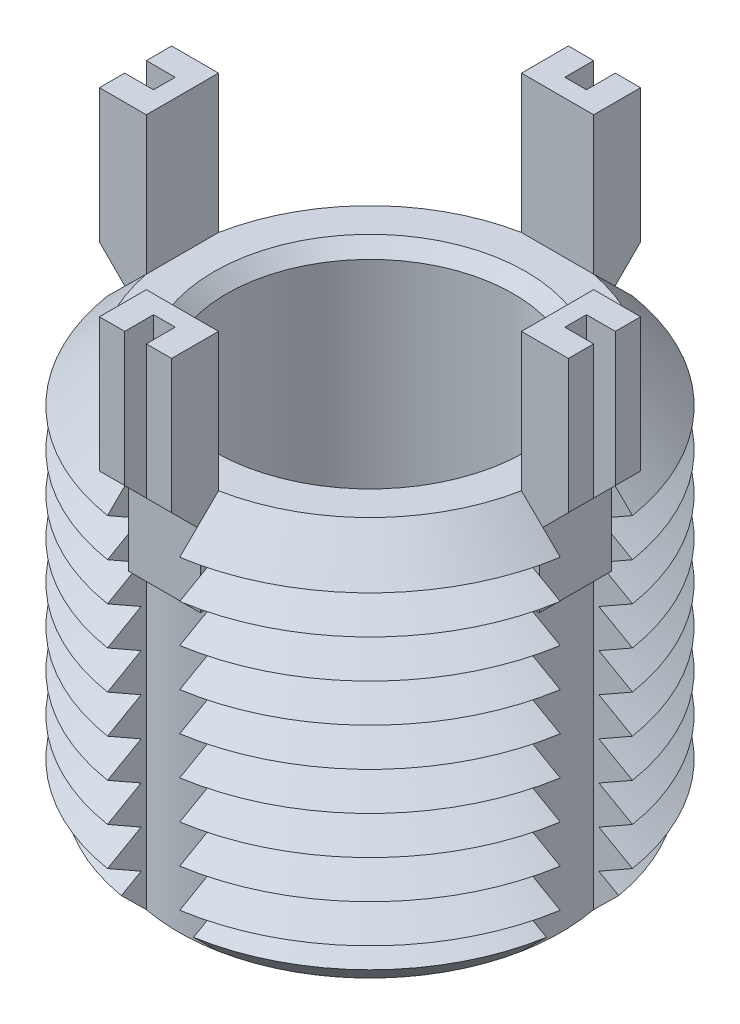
SolidWorks part; units mm, degrees
ref_plane "Front Plane" through (0, 0, 0) normal (0, 0, 1) x (1, 0, 0)
ref_plane "Top Plane" through (0, 0, 0) normal (0, 1, 0) x (1, 0, 0)
ref_plane "Right Plane" through (0, 0, 0) normal (1, 0, 0) x (0, 0, -1)
sketch "Sketch1" plane through (0, 0, 0) normal (0, 1, 0) x (1, 0, 0)
  circle A0 centre (0, 0) radius 12.7
  dimension "D1" = 25.4
extrude "Boss-Extrude1" add sketch "Sketch1" against normal blind 22.098
chamfer "Chamfer1" distance 2.117 angle 45 2 edges at (0, -22.098, 12.7) (0, 0, 12.7)
sketch "Sketch2" plane through (0, 0, 0) normal (1, 0, 0) x (0, 0, -1)
  line L0 (0, 0.8859) -> (0, -9.2617) construction
sketch "Sketch3" plane through (0, 0, 0) normal (1, 0, 0) x (0, 0, -1)
  line L0 (-12.7, -2.117) -> (-10.8666, -3.1755)
  line L1 (-10.8666, -3.1755) -> (-12.7, -4.234)
  line L2 (-12.7, -2.117) -> (-12.7, -19.981) construction
  line L3 (-12.7, -4.234) -> (-12.7, -2.117)
  dimension "D1" = 2.117
revolve "Cut-Revolve1" cut sketch "Sketch3" angle 360 about L0
pattern_linear "LPattern1" count 9 spacing 2.117 along (0, -1, 0) of "Cut-Revolve1"
sketch "Sketch4" plane through (0, 0, 0) normal (0, 1, 0) x (1, 0, 0)
  line L0 (-10.3923, 2) -> (-12.5415, 2)
  line L2 (-12.5415, -2) -> (-10.3923, -2)
  arc A0 (-10.3923, 2) -> (-10.3923, -2) centre (0, 0) ccw
  arc A1 (-12.5415, 2) -> (-12.5415, -2) centre (0, 0) ccw
  circle A2 centre (0, 0) radius 12.7 construction
  circle A3 centre (0, 0) radius 10.583 construction
  point P1 (-10.583, 0)
  point P3 (-12.7, 0)
  point P13 (0, 0)
  dimension "D1" = 4
extrude "Cut-Extrude1" cut sketch "Sketch4" against normal up to surface (22.098 mm away)
pattern_circular "CirPattern1" count 4 over 360 about axis through (0, 0, 0) along (0, 1, 0) of "Cut-Extrude1"
sketch "Sketch5" plane through (0, 0, 0) normal (1, 0, 0) x (0, 0, -1)
  line L0 (-10.3923, 7.649) -> (-10.3923, -5.351)
  line L1 (-10.3923, -5.351) -> (-11.3923, -5.351)
  line L2 (-11.3923, -5.351) -> (-11.3923, -1.351)
  line L3 (-11.3923, -1.351) -> (-12.9923, 0.249)
  line L4 (-12.9923, 0.249) -> (-12.9923, 7.649)
  line L5 (-12.9923, 7.649) -> (-10.3923, 7.649)
  line L6 (-12.5415, -6.351) -> (-2, -6.351) construction
  point P9 (-2, 0)
  point P10 (-11.3923, -1.351)
  dimension "D1" = 1
  dimension "D2" = 13
  dimension "D3" = 9
  dimension "D4" = 2.6
  dimension "D5" = 1
  dimension "D6" = 45
extrude "Boss-Extrude3" add sketch "Sketch5" along normal mid plane 4
pattern_circular "CirPattern2" count 4 over 360 about axis through (0, 0, 0) along (0, 1, 0) of "Boss-Extrude3"
sketch "Sketch6" plane through (0, 7.649, 0) normal (0, 1, 0) x (1, 0, 0)
  line L0 (-12.9923, -2) -> (-12.9923, 2) construction
  line L1 (-12.9923, -0.6) -> (-11.3923, -0.6)
  line L2 (-12.9923, -0.6) -> (-12.9923, 0.6)
  line L3 (-12.9923, 0.6) -> (-11.3923, 0.6)
  line L4 (-11.3923, -0.6) -> (-11.3923, 0.6)
  line L5 (-12.9923, -0.6) -> (-11.3923, 0.6) construction
  line L6 (-12.9923, 0.6) -> (-11.3923, -0.6) construction
  line L7 (12.9923, 2) -> (12.9923, -2) construction
  line L8 (-0.6, 11.3923) -> (0.6, 11.3923)
  line L9 (-0.6, 11.3923) -> (-0.6, 12.9923)
  line L10 (-0.6, 12.9923) -> (0.6, 12.9923)
  line L11 (0.6, 11.3923) -> (0.6, 12.9923)
  line L12 (-0.6, 11.3923) -> (0.6, 12.9923) construction
  line L13 (-0.6, 12.9923) -> (0.6, 11.3923) construction
  line L14 (11.3923, -0.6) -> (12.9923, -0.6)
  line L15 (11.3923, -0.6) -> (11.3923, 0.6)
  line L16 (11.3923, 0.6) -> (12.9923, 0.6)
  line L17 (12.9923, -0.6) -> (12.9923, 0.6)
  line L18 (11.3923, -0.6) -> (12.9923, 0.6) construction
  line L19 (11.3923, 0.6) -> (12.9923, -0.6) construction
  line L20 (-0.6, -12.9923) -> (0.6, -12.9923)
  line L21 (-0.6, -12.9923) -> (-0.6, -11.3923)
  line L22 (-0.6, -11.3923) -> (0.6, -11.3923)
  line L23 (0.6, -12.9923) -> (0.6, -11.3923)
  line L24 (-0.6, -12.9923) -> (0.6, -11.3923) construction
  line L25 (-0.6, -11.3923) -> (0.6, -12.9923) construction
  line L26 (-2, 12.9923) -> (2, 12.9923) construction
  line L27 (2, -12.9923) -> (-2, -12.9923) construction
  point P0 (-12.1923, 0)
  point P7 (-12.9923, 0)
  point P8 (-12.9923, 0)
  point P9 (0, 12.1923)
  point P14 (12.1923, 0)
  point P19 (0, -12.1923)
  point P24 (0, 12.9923)
  point P25 (12.9923, 0)
  point P26 (12.9923, 0)
  point P27 (0, 12.9923)
  point P30 (0, -12.9923)
  point P33 (0, -12.9923)
  dimension "D1" = 1.2
  dimension "D2" = 1.6
extrude "Cut-Extrude3" cut sketch "Sketch6" against normal through all both and the other way through all
sketch "Sketch7" plane through (0, 0, 0) normal (0, 1, 0) x (1, 0, 0)
  circle A0 centre (0, 0) radius 7.9375
  dimension "D1" = 15.875
extrude "Cut-Extrude4" cut sketch "Sketch7" against normal up to surface (22.098 mm away)
chamfer "Chamfer2" distance 0.7055 angle 45 2 edges at (0, 0, 7.9375) (0, -22.098, 7.9375)
